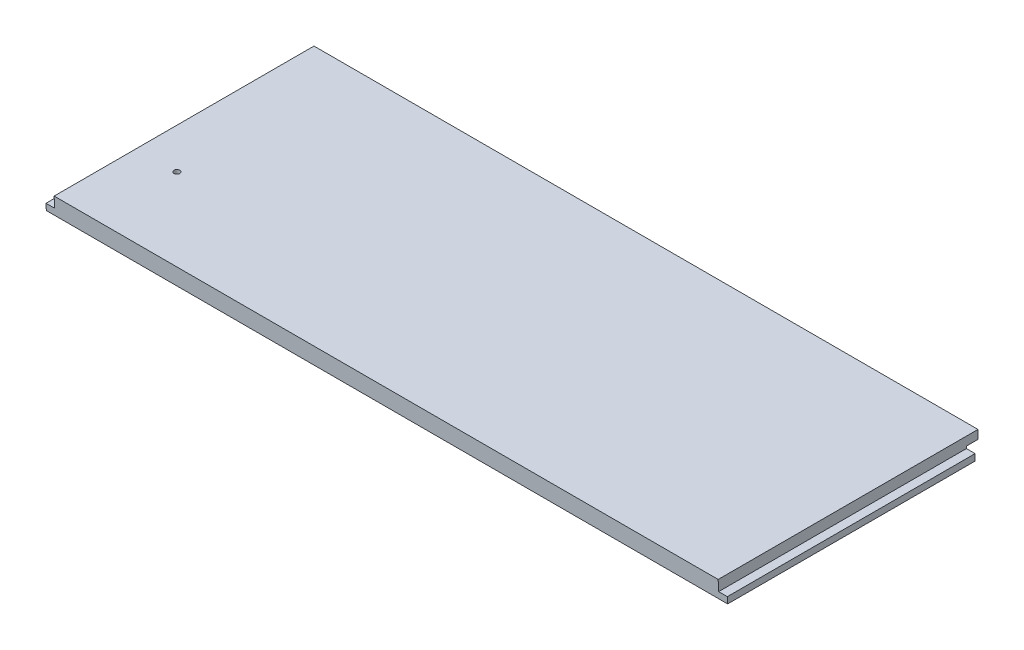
SolidWorks part; units mm, degrees
ref_plane "Front Plane" through (0, 0, 0) normal (0, 0, 1) x (1, 0, 0)
ref_plane "Top Plane" through (0, 0, 0) normal (0, 1, 0) x (1, 0, 0)
ref_plane "Right Plane" through (0, 0, 0) normal (1, 0, 0) x (0, 0, -1)
sketch "Sketch1" plane through (0, 0, 0) normal (0, 1, 0) x (1, 0, 0)
  line L1 (-374.65, -142.875) -> (374.65, -142.875)
  line L2 (-374.65, -142.875) -> (-374.65, 142.875)
  line L3 (-374.65, 142.875) -> (374.65, 142.875)
  line L4 (374.65, -142.875) -> (374.65, 142.875)
  line L5 (-374.65, -142.875) -> (374.65, 142.875) construction
  line L6 (-374.65, 142.875) -> (374.65, -142.875) construction
  point P0 (0, 0)
  dimension "D1" = 749.3
  dimension "D2" = 285.75
extrude "Boss-Extrude1" add sketch "Sketch1" against normal blind 19.05
sketch "Sketch2" plane through (-374.65, 0, 0) normal (-1, 0, 0) x (0, 0, 1)
  line L0 (142.875, 0) -> (140.6882, -45.8183)
  line L1 (142.875, -19.05) -> (142.875, 0) construction
  dimension "D1" = 2.733
extrude "Cut-Extrude1" cut sketch "Sketch2" against normal through all and the other way through all
sketch "Sketch3" plane through (0, 0, -142.875) normal (0, 0, -1) x (-1, 0, 0)
  line L1 (374.65, 0) -> (365.125, 0)
  line L2 (374.65, 0) -> (374.65, -11.9062)
  line L3 (374.65, -11.9062) -> (365.125, -11.9063)
  line L4 (365.125, 0) -> (365.125, -11.9063)
  line L5 (-374.65, 0) -> (-365.125, 0)
  line L6 (-374.65, 0) -> (-374.65, -11.9062)
  line L7 (-374.65, -11.9062) -> (-365.125, -11.9062)
  line L8 (-365.125, 0) -> (-365.125, -11.9062)
  dimension "D1" = 9.525
  dimension "D2" = 11.9062
extrude "Cut-Extrude2" cut sketch "Sketch3" against normal through all
sketch "Sketch4" plane through (374.65, 0, 0) normal (1, 0, 0) x (0, 0, -1)
  line L1 (142.875, -19.05) -> (130.175, -19.05)
  line L2 (142.875, -19.05) -> (142.875, -9.525)
  line L3 (142.875, -9.525) -> (130.175, -9.525)
  line L4 (130.175, -19.05) -> (130.175, -9.525)
  dimension "D1" = 12.7
  dimension "D2" = 9.525
extrude "Cut-Extrude3" cut sketch "Sketch4" against normal through all
sketch "Sketch5" plane through (0, 0, 0) normal (0, 1, 0) x (1, 0, 0)
  line L0 (365.125, 142.875) -> (-365.125, 142.875) construction
  line L1 (-365.125, -142.875) -> (-365.125, 142.875) construction
  circle A0 centre (-320.675, -52.3875) radius 3.175
  dimension "D1" = 6.35
  dimension "D2" = 195.2625
  dimension "D3" = 44.45
extrude "Cut-Extrude4" cut sketch "Sketch5" against normal through all
